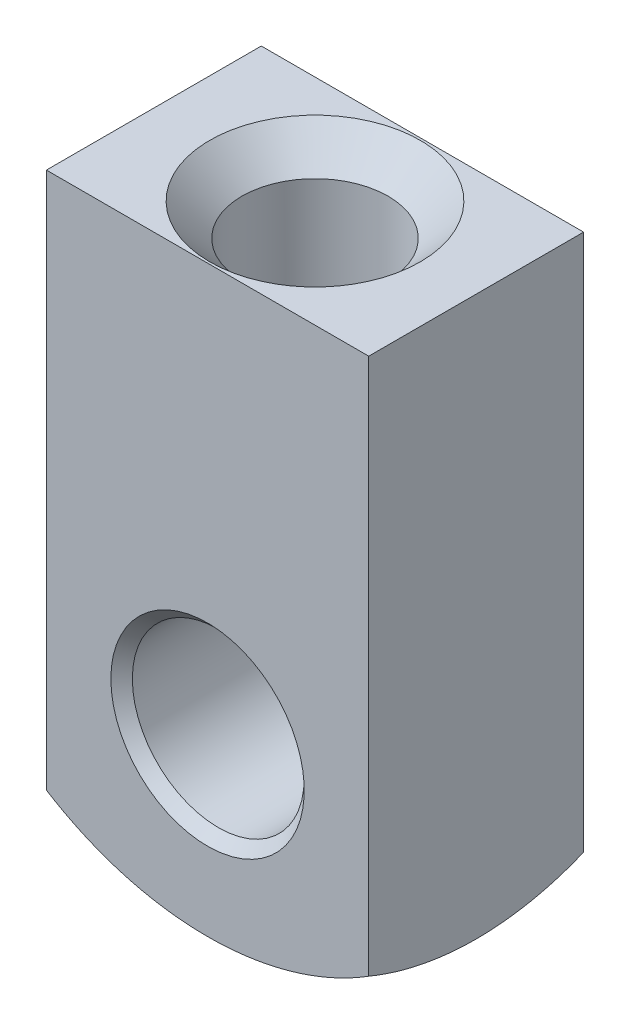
SolidWorks part; units mm, degrees
ref_plane "Plan de face" through (0, 0, 0) normal (0, 0, 1) x (1, 0, 0)
ref_plane "Plan de dessus" through (0, 0, 0) normal (0, 1, 0) x (1, 0, 0)
ref_plane "Plan de droite" through (0, 0, 0) normal (1, 0, 0) x (0, 0, -1)
sketch "Esquisse1" plane through (0, 0, 0) normal (0, 0, 1) x (1, 0, 0)
  line L0 (0, 39.3132) -> (0, -22.6648) construction
  line L1 (-7.5, -9) -> (7.5, -9)
  line L2 (-7.5, -9) -> (-7.5, 19)
  line L3 (-7.5, 19) -> (7.5, 19)
  line L4 (7.5, -9) -> (7.5, 19)
  dimension "D1" = 15
  dimension "D2" = 28
  dimension "D3" = 9
extrude "Boss.-Extru.1" add sketch "Esquisse1" along normal mid plane 10
sketch "Esquisse3" plane through (0, 0, 0) normal (0, 0, 1) x (1, 0, 0)
  line L0 (0, -9) -> (0, -10)
  line L1 (-7.5, -9) -> (7.5, -9) construction
  line L2 (0, -10) -> (10, -10)
  line L3 (10, -10) -> (10, -5.1803)
  line L4 (0, 8.2199) -> (0, -20.7294) construction
  arc A0 (0, -9) -> (10, -5.1803) centre (0, 6) ccw
  dimension "D1" = 15
  dimension "D2" = 1
  dimension "D3" = 10
revolve "Enlèvement de matière-Révolution4" cut sketch "Esquisse3" angle 360 about L4
sketch "Esquisse4" plane through (0, 0, 5) normal (0, 0, 1) x (1, 0, 0)
  circle A0 centre (0, 0) radius 4
  dimension "D1" = 8
extrude "Enlèv. mat.-Extru.1" cut sketch "Esquisse4" against normal through all
chamfer "Chanfrein1" distance 0.5 angle 45 2 edges at (4, 0, 5) (4, 0, -5)
hole_wizard "Trou taraudé M81" positions "Esquisse6" profile "Esquisse5" tap size "M8" standard "ISO"
sketch "Esquisse6" plane through (0, 19, 0) normal (0, 1, 0) x (1, 0, 0)
  point P0 (0, 0)
sketch "Esquisse5" plane through (0, 19, 0) normal (1, 0, 0) x (0, 0, 1)
  line L0 (0, 0) -> (0, 14.0429)
  line L1 (0, 14.0429) -> (3.4, 12)
  line L2 (3.4, 12) -> (3.4, 0)
  line L5 (3.4, 0) -> (0, 0)
  line L10 (0, 14.0429) -> (-3.4, 12) construction
  line L11 (0, -6.35) -> (0, 107.95) construction
  dimension "Diamètre du trou pour taraudage" = 6.8
  dimension "Profondeur du trou pour taraudage" = 12
  dimension "Angle de pointe" = 118
chamfer "Chanfrein2" distance 1.5 angle 45 1 edges at (0, 19, 3.4)
